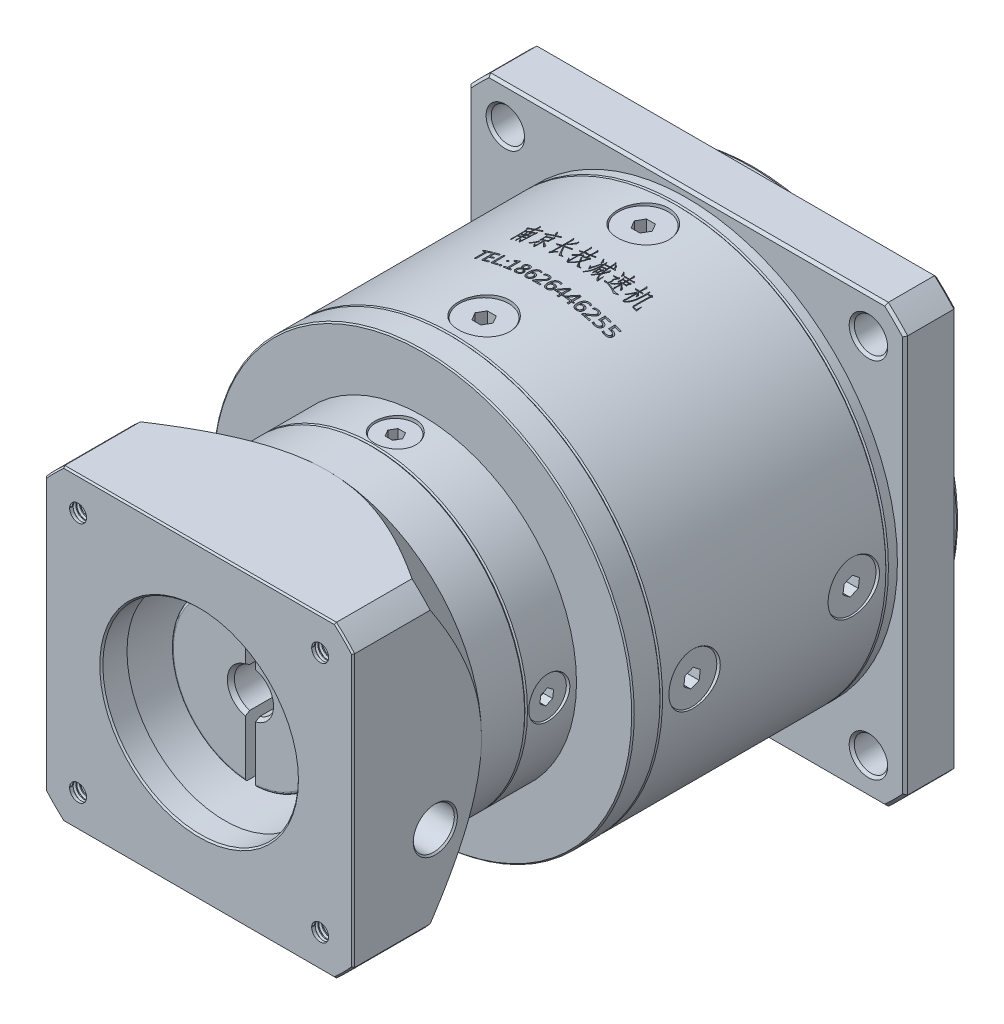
SolidWorks part; units mm, degrees
ref_plane "前视基准面" through (0, 0, 0) normal (0, 0, 1) x (1, 0, 0)
ref_plane "上视基准面" through (0, 0, 0) normal (0, 1, 0) x (1, 0, 0)
ref_plane "右视基准面" through (0, 0, 0) normal (1, 0, 0) x (0, 0, -1)
imported_body "8-38.1-47.14X47.14-M4-1-solid1"
imported_body "8-38.1-47.14X47.14-M4-1-solid2"
imported_body "8-38.1-47.14X47.14-M4-1-solid3"
imported_body "8-38.1-47.14X47.14-M4-1-solid4"
imported_body "8-38.1-47.14X47.14-M4-1-solid5"
imported_body "ZF80-K15-L2-F60-3-solid1"
imported_body "ZF80-K15-L2-F60-3-solid2"
imported_body "ZF80-K15-L2-F60-3-solid3"
imported_body "ZF80-K15-L2-F60-3-solid4"
imported_body "ZF80-K15-L2-F60-3-solid5"
imported_body "ZF80-K15-L2-F60-3-solid6"
imported_body "ZF80-K15-L2-F60-3-solid7"
imported_body "ZF80-K15-L2-F60-3-solid8"
imported_body "ZF80-K15-L2-F60-3-solid9"
imported_body "ZF80-K15-L2-F60-3-solid10"
imported_body "ZF80-K15-L2-F60-3-solid11"
imported_body "ZF80-K15-L2-F60-3-solid12"
imported_body "ZF80-K15-L2-F60-3-solid13"
sketch "草图1" plane through (0, 0, -51.4184) normal (0, 0, -1) x (-1, 0, 0)
  circle A0 centre (63.0095, 20.5162) radius 11.2786
  dimension "D1" = 22.5572
extrude "凸台-拉伸1" add sketch "草图1" along normal blind 5
